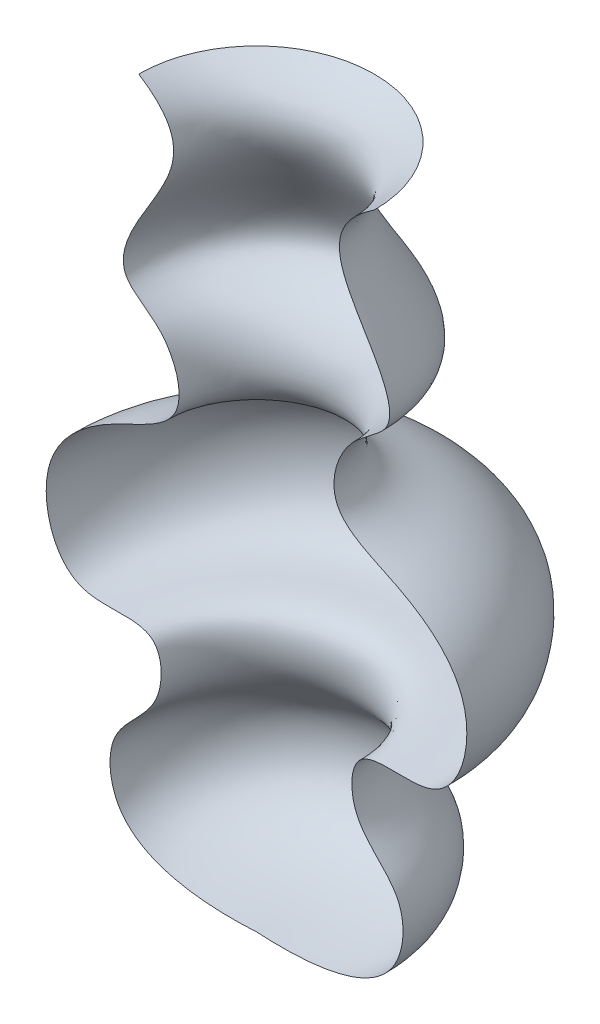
SolidWorks part; units mm, degrees
ref_plane "Vorne" through (0, 0, 0) normal (0, 0, 1) x (1, 0, 0)
ref_plane "Oben" through (0, 0, 0) normal (0, 1, 0) x (1, 0, 0)
ref_plane "Rechts" through (0, 0, 0) normal (1, 0, 0) x (0, 0, -1)
sketch "Skizze1" plane through (0, 0, 0) normal (0, 0, 1) x (1, 0, 0)
  spline S0 degree 3 poles (16.761, 38.575) (9.2702, 33.718) (13.1546, 26.2806) (21.5932, 13.0282) (12.3164, 8.7422) (9.0789, -1.9804) (22.2542, -6.2492) (32.3733, -15.2821) (27.3743, -31.9748) (13.5275, -27.1374) (13.1748, -39.1043) (21.5686, -43.1651) (20.3193, -59.0766) (5.624, -59.1073) (0, -58.7867) knots 0 0 0 0 0.124587 0.207254 0.252899 0.317209 0.396194 0.504166 0.592331 0.668564 0.713466 0.789022 0.846426 1 1 1 1
ref_plane "Ebene1" through (0, 38.575, 0) normal (0, 1, 0) x (-1, 0, 0)
sketch "Skizze2" plane through (0, 38.575, 0) normal (0, 1, 0) x (-1, 0, 0)
  arc A0 (16.761, 0) -> (-16.761, 0) centre (0, 0) cw
surface "Oberfläche-Austragung1"
